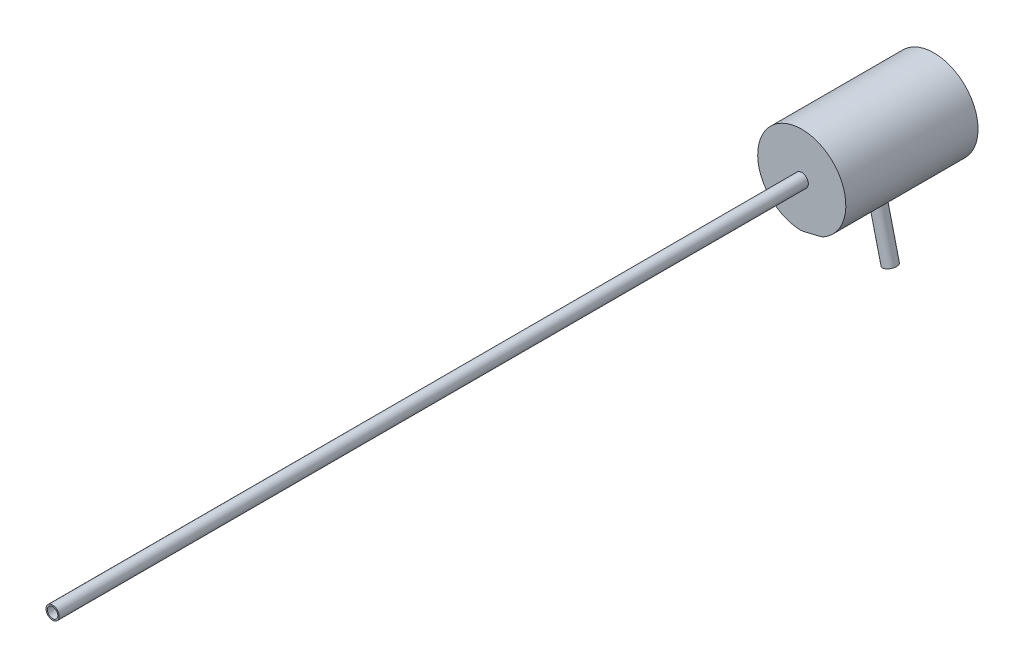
SolidWorks part; units mm, degrees
ref_plane "Front Plane" through (0, 0, 0) normal (0, 0, 1) x (1, 0, 0)
ref_plane "Top Plane" through (0, 0, 0) normal (0, 1, 0) x (1, 0, 0)
ref_plane "Right Plane" through (0, 0, 0) normal (1, 0, 0) x (0, 0, -1)
sketch "Sketch1" plane through (0, 0, 0) normal (0, 0, 1) x (1, 0, 0)
  circle A0 centre (0, 0) radius 12.7
  dimension "D1" = 25.4
extrude "Extrude1" add sketch "Sketch1" along normal blind 38.1
sketch "Sketch2" plane through (0, 0, 38.1) normal (0, 0, 1) x (1, 0, 0)
  circle A0 centre (0, 0) radius 1.905
  circle A1 centre (0, 0) radius 1.5037
  dimension "D1" = 3.81
extrude "Extrude2" add sketch "Sketch2" along normal blind 215.9
sketch "Sketch3" plane through (0, 0, 0) normal (0, 0, -1) x (-1, 0, 0)
  line L0 (0, -12.7) -> (-5.8003, -11.2981)
  line L1 (-5.8003, -11.2981) -> (-3.3919, -15.2418)
  line L2 (-3.3919, -15.2418) -> (0, -12.7)
  circle A0 centre (0, 0) radius 12.7 construction
extrude "Cut-Extrude1" cut sketch "Sketch3" against normal blind 101.6
sketch "Sketch4" plane through (2.9002, -11.999, 0) normal (0.2349, -0.972, 0) x (0.972, 0.2349, 0)
  circle A0 centre (0, 19.1835) radius 1.905
  circle A1 centre (0, 19.1835) radius 1.536
extrude "Extrude3" add sketch "Sketch4" along normal blind 15.7163
fillet "Fillet2" radius 5.08 2 edges at (5.8003, -11.2981, 19.05) (0, -12.7, 19.05)
